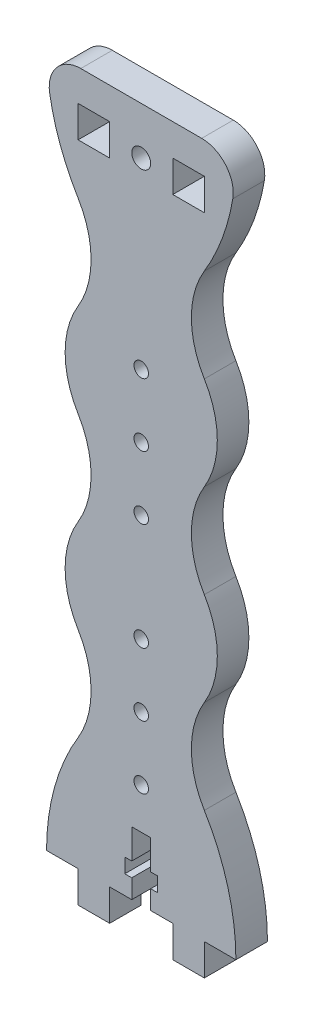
SolidWorks part; units mm, degrees
ref_plane "Plan de face" through (0, 0, 0) normal (0, 0, 1) x (1, 0, 0)
ref_plane "Plan de dessus" through (0, 0, 0) normal (0, 1, 0) x (1, 0, 0)
ref_plane "Plan de droite" through (0, 0, 0) normal (1, 0, 0) x (0, 0, -1)
sketch "Esquisse1" plane through (0, 0, 0) normal (0, 0, 1) x (1, 0, 0)
  line L0 (5, 0) -> (0, 0)
  line L1 (0, 0) -> (30, 0) construction
  line L2 (0, 0) -> (0, 100) construction
  line L3 (0, 0) -> (0, 110) construction
  line L4 (30, 0) -> (30, 50) construction
  line L5 (0, 110) -> (30, 110)
  line L6 (30, 110) -> (30, 0) construction
  line L7 (30, 0) -> (25, 0)
  line L8 (15, 73.5) -> (15, 36.5) construction
  line L9 (13.5, 0) -> (10, 0)
  line L10 (10, -5) -> (5, -5)
  line L11 (5, -5) -> (5, 0)
  line L12 (10, -5) -> (10, 0)
  line L13 (16.5, 0) -> (20, 0)
  line L14 (20, 0) -> (20, -5)
  line L15 (20, -5) -> (25, -5)
  line L16 (5, 100) -> (5, 0) construction
  line L17 (0, 55) -> (30, 55) construction
  line L19 (25, -5) -> (25, 0)
  line L20 (13.5, 0) -> (16.5, 0) construction
  line L21 (16.5, 0) -> (16.5, 3)
  line L22 (16.5, 5.3) -> (17.6, 5.3)
  line L23 (12.4, 3) -> (12.4, 5.3)
  line L24 (17.6, 3) -> (16.5, 3)
  line L25 (16.5, 5.3) -> (16.5, 10)
  line L26 (16.5, 10) -> (13.5, 10)
  line L27 (13.5, 10) -> (13.5, 5.3)
  line L28 (13.5, 3) -> (12.4, 3)
  line L29 (17.6, 5.3) -> (17.6, 3)
  line L30 (12.4, 5.3) -> (13.5, 5.3)
  line L31 (13.5, 3) -> (13.5, 0)
  line L32 (15, 10) -> (15, 0) construction
  circle A0 centre (15, 26.5) radius 1.15
  circle A1 centre (15, 63.5) radius 1.15
  circle A2 centre (15, 16.5) radius 1.15
  circle A3 centre (15, 53.5) radius 1.15
  circle A4 centre (15, 73.5) radius 1.15
  circle A5 centre (15, 36.5) radius 1.15
  arc A6 (0, 110) -> (5, 92) centre (34.9, 110) ccw
  arc A7 (5, 92) -> (5, 77.2) centre (-7.2922, 84.6) cw
  arc A8 (5, 77.2) -> (5, 62.4) centre (17.2922, 69.8) ccw
  arc A9 (5, 62.4) -> (5, 47.6) centre (-7.2922, 55) cw
  arc A10 (5, 47.6) -> (5, 32.8) centre (17.2922, 40.2) ccw
  arc A11 (5, 32.8) -> (5, 18) centre (-7.2922, 25.4) cw
  arc A12 (5, 18) -> (0, 0) centre (34.9, 0) ccw
  arc A13 (25, 18) -> (30, 0) centre (-4.9, 0) cw
  arc A14 (25, 32.8) -> (25, 18) centre (37.2922, 25.4) ccw
  arc A15 (25, 47.6) -> (25, 32.8) centre (12.7078, 40.2) cw
  arc A16 (25, 62.4) -> (25, 47.6) centre (37.2922, 55) ccw
  arc A17 (25, 77.2) -> (25, 62.4) centre (12.7078, 69.8) cw
  arc A18 (25, 92) -> (25, 77.2) centre (37.2922, 84.6) ccw
  arc A19 (30, 110) -> (25, 92) centre (-4.9, 110) cw
  point P10 (15, 0)
  point P50 (0, 55)
  line B0 (10, 105) -> (5, 105)
  line B1 (10, 105) -> (10, 100)
  line B2 (10, 100) -> (5, 100)
  line B3 (5, 105) -> (5, 100)
  line B4 (20, 105) -> (25, 105)
  line B5 (20, 105) -> (20, 100)
  line B6 (20, 100) -> (25, 100)
  line B7 (25, 105) -> (25, 100)
  line B8 (15, 102.5) -> (15, 109.4724) construction
  circle B9 centre (15, 102.5) radius 1.5
  dimension "D5" = 2.3
  dimension "D6" = 3
  dimension "D8" = 5
  dimension "D1" = 100
  dimension "D2" = 30
  dimension "D3" = 5
  dimension "D4" = 10
  dimension "D7" = 18
  dimension "D9" = 37
  dimension "D10" = 5
  dimension "D11" = 5.2
  dimension "D12" = 3
  dimension "D13" = 2.3
  dimension "D14" = 3
  dimension "D15" = 10
sketch_block_instance "Trou M3 plots 5mm-1"
sketch_block "Trou M3 plots 5mm" parameters "D2"=3, "D1"=5, "D3"=5, "D4"=10
extrude "Boss.-Extru.1" add sketch "Esquisse1" along normal blind 5
fillet "Congé1" radius 5 2 edges at (0, 110, 2.5) (30, 110, 2.5)
